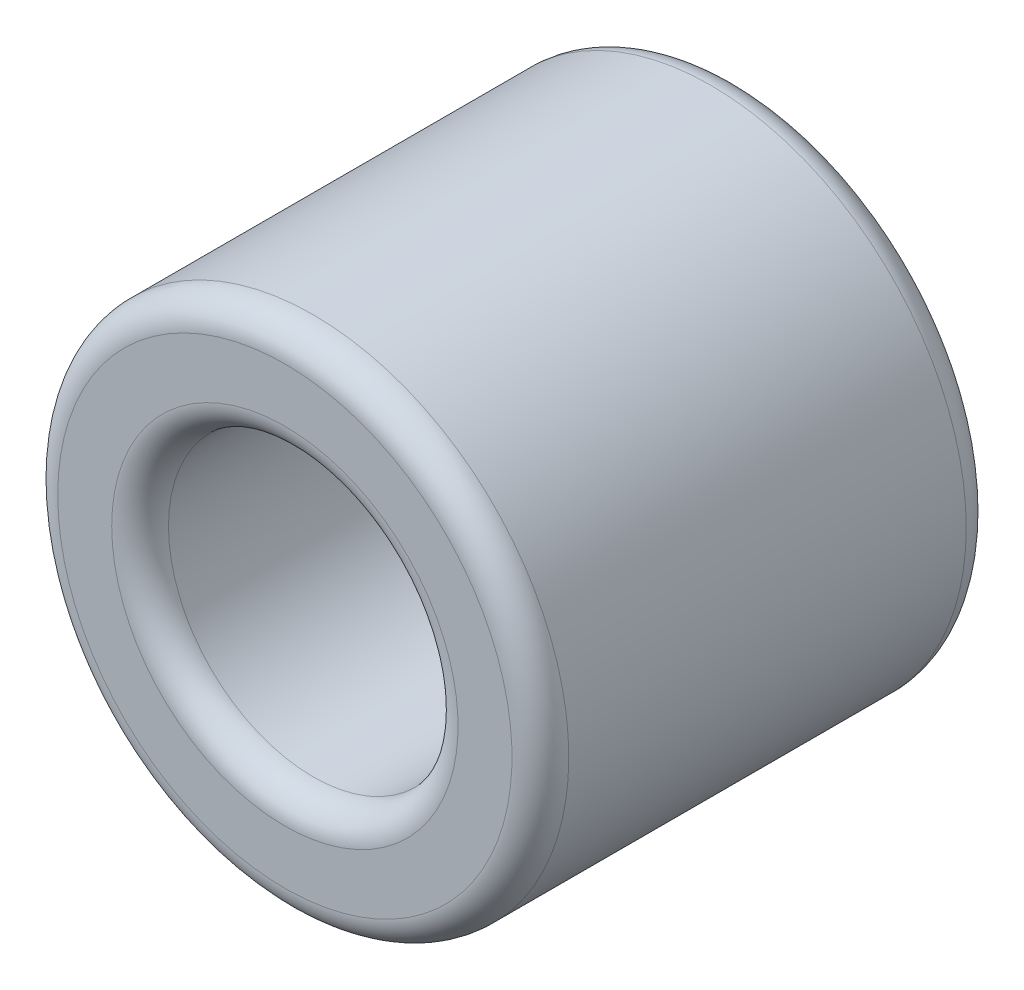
SolidWorks part; units mm, degrees
ref_plane "Спереди" through (0, 0, 0) normal (0, 0, 1) x (1, 0, 0)
ref_plane "Сверху" through (0, 0, 0) normal (0, 1, 0) x (1, 0, 0)
ref_plane "Справа" through (0, 0, 0) normal (1, 0, 0) x (0, 0, -1)
sketch "Эскиз1" plane through (0, 0, 0) normal (1, 0, 0) x (0, 0, -1)
  line L0 (-4, 0) -> (4, 0) construction
  line L1 (-4, 2.55) -> (4, 2.55)
  line L2 (4, 2.55) -> (4, 4.5)
  line L3 (4, 4.5) -> (-4, 4.5)
  line L4 (-4, 4.5) -> (-4, 2.55)
  dimension "D1" = 8
  dimension "D2" = 5.1
  dimension "D3" = 9
revolve "Повернуть1" add sketch "Эскиз1" angle 360 about L0
fillet "Скругление1" radius 0.5 4 edges at (4.5, 0, -4) (4.5, 0, 4) (2.55, 0, 4) (2.55, 0, -4)
